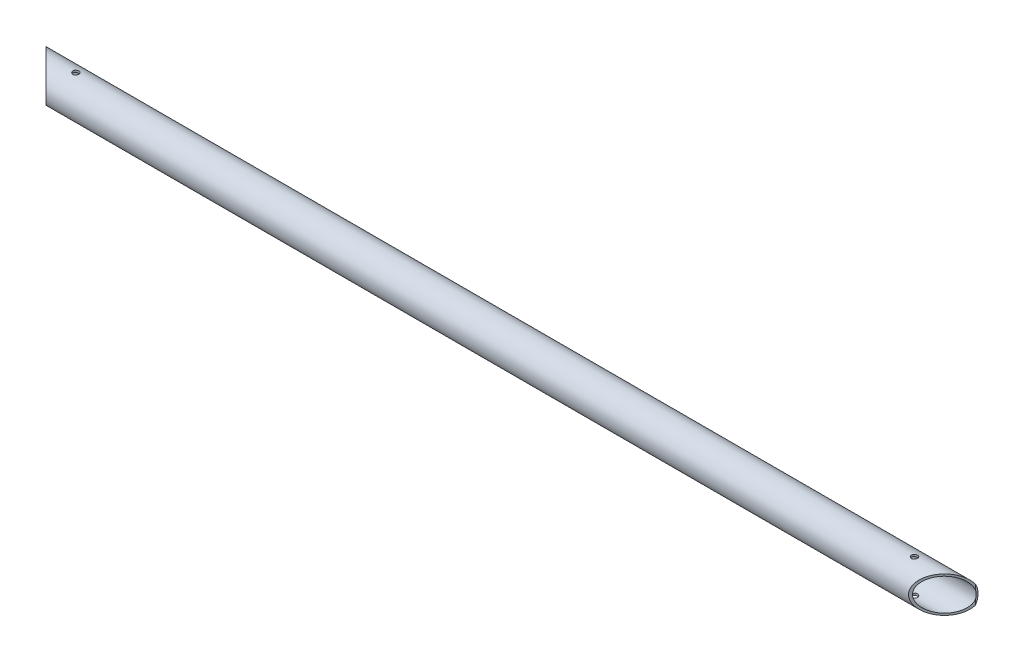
SolidWorks part; units mm, degrees
ref_plane "Front Plane" through (0, 0, 0) normal (0, 0, 1) x (1, 0, 0)
ref_plane "Top Plane" through (0, 0, 0) normal (0, 1, 0) x (1, 0, 0)
ref_plane "Right Plane" through (0, 0, 0) normal (1, 0, 0) x (0, 0, -1)
sketch "Sketch1" plane through (0, 0, 0) normal (1, 0, 0) x (0, 0, -1)
  circle A0 centre (0, 0) radius 19.05
  circle A1 centre (0, 0) radius 16.9418
  dimension "D1" = 38.1
  dimension "D2" = 2.1082
extrude "Extrude1" add sketch "Sketch1" along normal mid plane 990.6
sketch "Sketch4" plane through (0, 0, 0) normal (0, 1, 0) x (1, 0, 0)
  line L0 (495.3, -19.05) -> (495.3, 19.05) construction
  line L1 (-495.3, 19.05) -> (-495.3, -19.05) construction
  line L2 (-495.3, -19.05) -> (495.3, -19.05) construction
  line L3 (495.3, 19.05) -> (-495.3, 19.05) construction
  line L4 (495.3, -19.05) -> (495.3, 19.05)
  line L5 (-495.3, 19.05) -> (-495.3, -19.05)
  line L6 (-495.3, -19.05) -> (495.3, -19.05)
  line L7 (495.3, 19.05) -> (-495.3, 19.05)
  line L8 (-495.3, 19.05) -> (-457.2, -19.05)
  dimension "D1" = 45
extrude "Extrude2" cut sketch "Sketch4" against normal through all and the other way through all contours L8 L5 L6
mirror "Mirror1" about plane through (0, 0, 0) normal (1, 0, 0) of "Extrude2"
sketch "Sketch6" plane through (0, 0, 0) normal (0, 1, 0) x (1, 0, 0)
  line L0 (-495.3, 19.05) -> (-457.2, -19.05) construction
  line L1 (-495.3, 19.05) -> (-457.2, -19.05)
  line L2 (495.3, 19.05) -> (-495.3, 19.05) construction
  line L3 (495.3, 19.05) -> (-495.3, 19.05)
  line L4 (-492.76, 19.05) -> (-492.76, 16.51)
  dimension "D1" = 2.54
extrude "Extrude3" cut sketch "Sketch6" against normal through all and the other way through all contours L4 L3 L1
sketch "Sketch7" plane through (0, 0, 0) normal (0, 1, 0) x (1, 0, 0)
  line L0 (543.1131, 0) -> (-17.5559, 0) construction
  circle A0 centre (444.5, 0) radius 3.175
  dimension "D1" = 6.35
  dimension "D2" = 444.5
extrude "Cut-Extrude1" cut sketch "Sketch7" along normal through all and the other way through all
mirror "Mirror2" about plane through (0, 0, 0) normal (1, 0, 0) of "Extrude3"
mirror "Mirror3" about plane through (0, 0, 0) normal (1, 0, 0) of "Cut-Extrude1"
